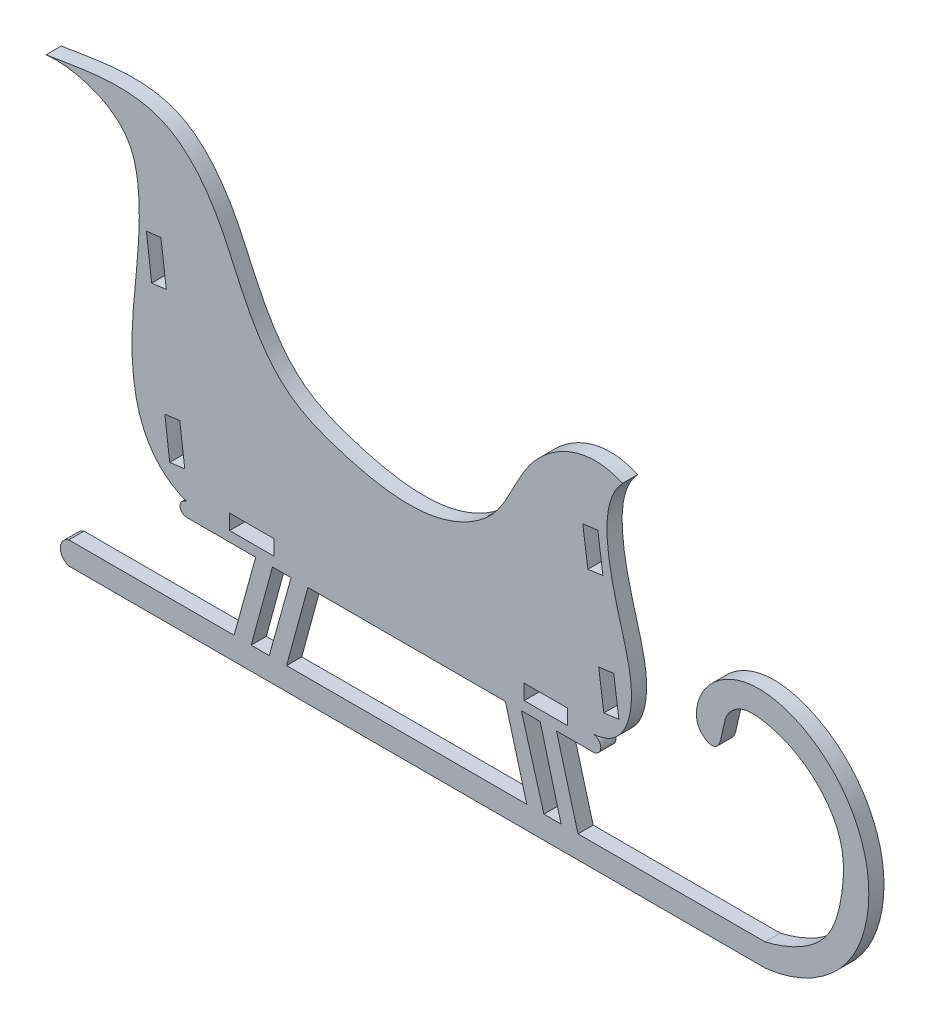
SolidWorks part; units mm, degrees
ref_plane "Plan de face" through (0, 0, 0) normal (0, 0, 1) x (1, 0, 0)
ref_plane "Plan de dessus" through (0, 0, 0) normal (0, 1, 0) x (1, 0, 0)
ref_plane "Plan de droite" through (0, 0, 0) normal (1, 0, 0) x (0, 0, -1)
sketch "Esquisse1" plane through (0, 0, 0) normal (0, 0, 1) x (1, 0, 0)
  line L0 (-84.1798, -61.0304) -> (53.6472, -61.0304)
  line L1 (-60.8201, -41.0336) -> (-47.1859, -41.0336)
  line L2 (-84.1798, -56.5465) -> (-51.4623, -56.5465)
  line L3 (-47.1859, -41.0336) -> (-51.4623, -56.5465)
  line L4 (-43.8543, -41.0336) -> (-48.081, -56.5465)
  line L5 (-40.1746, -41.0336) -> (-44.5007, -56.5465)
  line L6 (-36.843, -41.0336) -> (-41.0696, -56.5465)
  line L7 (2.2486, -41.0336) -> (6.4792, -56.5465)
  line L8 (5.4048, -41.0336) -> (9.8704, -56.5465)
  line L9 (9.1318, -41.0336) -> (13.2616, -56.5465)
  line L10 (12.3551, -41.0336) -> (16.6193, -56.5465)
  line L11 (-48.081, -56.5465) -> (-44.5007, -56.5465)
  line L12 (-41.0696, -56.5465) -> (6.4792, -56.5465)
  line L13 (9.8704, -56.5465) -> (13.2616, -56.5465)
  line L14 (16.6193, -56.5465) -> (53.6472, -56.5465)
  line L15 (-43.8543, -41.0336) -> (-40.1746, -41.0336)
  line L16 (-36.843, -41.0336) -> (2.2486, -41.0336)
  line L17 (5.4048, -41.0336) -> (9.1318, -41.0336)
  line L18 (12.3551, -41.0336) -> (19.5806, -41.0336)
  arc A0 (-60.8201, -38.3546) -> (-60.8201, -41.0336) centre (-60.8201, -39.6941) ccw
  arc A1 (19.5806, -37.9415) -> (19.5806, -41.0336) centre (19.5806, -39.4876) cw
  arc A2 (-84.1798, -56.5465) -> (-84.1798, -61.0304) centre (-83.5191, -58.7884) ccw
  spline S0 degree 3 poles (-88.6859, 24.3604) (-83.3968, 24.9563) (-71.9174, 21.8371) (-69.1711, 3.3863) (-73.396, -15.5961) (-70.0486, -34.7977) (-60.8201, -38.3546) knots 0 0 0 0 0.226947 0.344563 0.666347 1 1 1 1
  spline S1 degree 3 poles (-88.6859, 24.3604) (-81.5316, 25.435) (-67.5421, 28.7125) (-54.529, 15.1781) (-50.0001, 2.0094) (-41.7432, -10.487) (-27.4374, -15.8033) (-12.6339, -18.3948) (1.6375, -10.5745) (6.3356, 4.887) (18.2395, 11.1791) (25.4417, 7.9511) knots 0 0 0 0 0.166304 0.245586 0.366515 0.460246 0.543162 0.677096 0.761827 0.854728 1 1 1 1
  spline S2 degree 3 poles (25.4417, 7.9511) (22.4208, 4.6974) (21.7246, -4.7068) (25.1499, -16.5519) (28.4776, -28.8606) (25.23, -37.5869) (19.5806, -37.9415) knots 0 0 0 0 0.248798 0.526227 0.732928 1 1 1 1
  spline S3 degree 3 poles (53.6472, -56.5465) (58.0534, -55.5047) (66.2346, -51.8435) (69.1494, -40.8991) (69.5543, -31.2135) (63.3591, -22.5492) (55.5498, -18.8283) (48.8553, -18.3599) (45.4758, -21.6745) (45.3999, -24.9389) (44.0032, -28.9565) (40.243, -27.0275) (39.7318, -22.5055) (42.6828, -16.7576) (50.99, -12.5993) (61.4335, -15.2394) (69.7533, -22.4634) (74.3117, -32.338) (74.4178, -42.8255) (69.3824, -55.3838) (59.9292, -60.4336) (53.6472, -61.0304) knots 0 0 0 0 0.088776 0.144 0.202223 0.264386 0.328355 0.361063 0.3802 0.408187 0.424716 0.443517 0.464072 0.504919 0.555748 0.624981 0.691371 0.756104 0.821303 0.881682 1 1 1 1
extrude "Boss.-Extru.1" add sketch "Esquisse1" along normal blind 3
sketch "Esquisse2" plane through (0, 0, 0) normal (0, 0, 1) x (1, 0, 0)
  line L0 (20.5393, -2.5198) -> (21.5398, -9.8108)
  line L1 (-52.3332, -36.0371) -> (-43.6048, -36.0371)
  line L2 (-52.3332, -36.0371) -> (-52.3332, -39.0371)
  line L3 (-52.3332, -39.0371) -> (-43.6048, -39.0371)
  line L4 (-43.6048, -36.0371) -> (-43.6048, -39.0371)
  line L5 (5.9607, -39.0371) -> (14.5843, -39.0371)
  line L6 (5.9607, -39.0371) -> (5.9607, -36.0371)
  line L7 (5.9607, -36.0371) -> (14.5843, -36.0371)
  line L8 (14.5843, -39.0371) -> (14.5843, -36.0371)
  line L9 (20.5393, -2.5198) -> (17.5672, -2.9276)
  line L10 (17.5672, -2.9276) -> (18.5676, -10.2186)
  line L11 (21.7314, -33.2746) -> (24.7036, -32.8668)
  line L12 (-68.811, 4.0665) -> (-67.7747, -4.3328)
  line L13 (-64.2038, -33.2746) -> (-61.2264, -32.9073)
  line L14 (-68.811, 4.0665) -> (-65.9381, 4.421)
  line L15 (-65.9381, 4.421) -> (-64.8783, -3.9754)
  line L16 (-65.1644, -25.4894) -> (-62.2098, -25.1165)
  line L17 (-67.7747, -4.3328) -> (-64.8783, -3.9754)
  line L18 (21.5398, -9.8108) -> (18.5676, -10.2186)
  line L19 (23.6912, -25.4894) -> (20.7191, -25.8973)
  line L20 (-62.2098, -25.1165) -> (-61.2264, -32.9073)
  line L21 (-65.1644, -25.4894) -> (-64.2038, -33.2746)
  line L22 (20.7191, -25.8973) -> (21.7314, -33.2746)
  line L23 (23.6912, -25.4894) -> (24.7036, -32.8668)
  dimension "D1" = 3
extrude "Enlèv. mat.-Extru.3" cut sketch "Esquisse2" along normal blind 3
